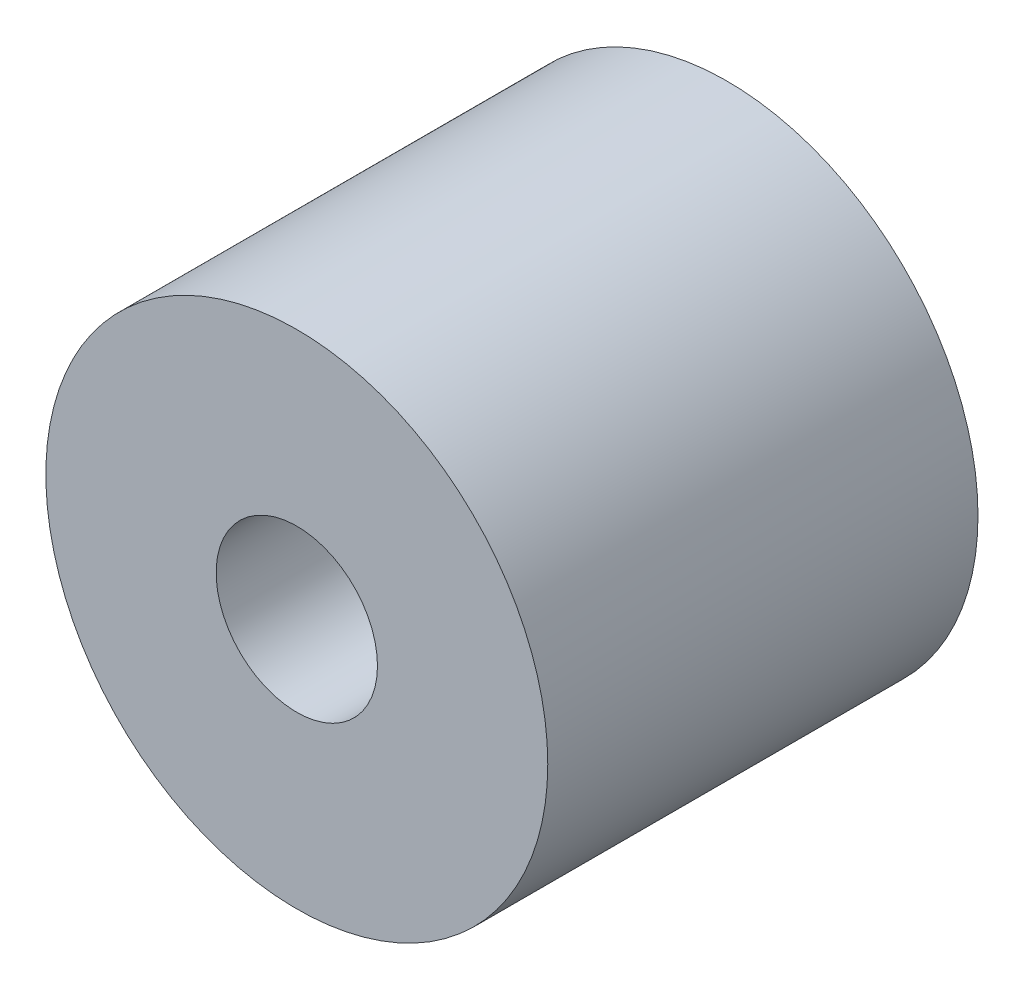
SolidWorks part; units mm, degrees
ref_plane "Front Plane" through (0, 0, 0) normal (0, 0, 1) x (1, 0, 0)
ref_plane "Top Plane" through (0, 0, 0) normal (0, 1, 0) x (1, 0, 0)
ref_plane "Right Plane" through (0, 0, 0) normal (1, 0, 0) x (0, 0, -1)
sketch "Sketch1" plane through (0, 0, 0) normal (0, 0, 1) x (1, 0, 0)
  circle A0 centre (0, 0) radius 2.25
  circle A1 centre (0, 0) radius 7
  dimension "D1" = 14
  dimension "D2" = 4.5
extrude "Boss-Extrude1" add sketch "Sketch1" along normal blind 12
